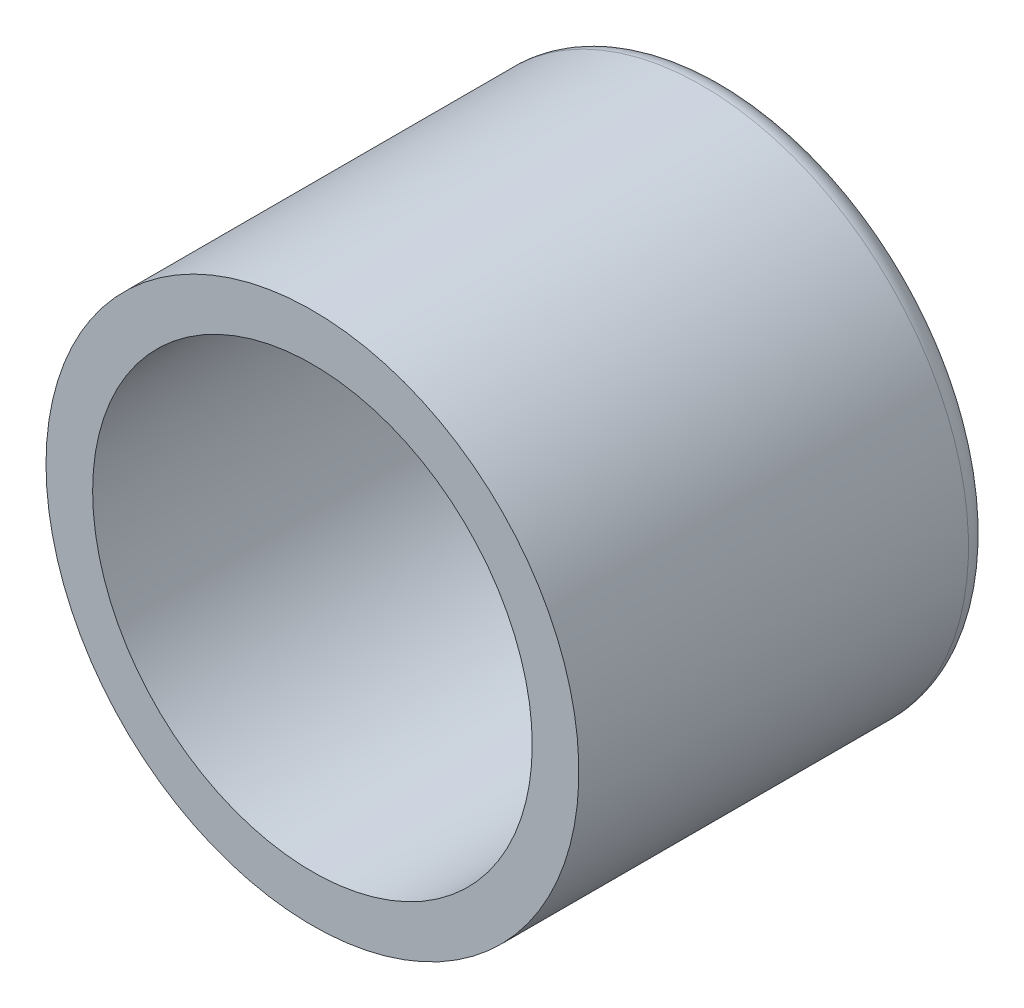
SolidWorks part; units mm, degrees
ref_plane "Plan de face" through (0, 0, 0) normal (0, 0, 1) x (1, 0, 0)
ref_plane "Plan de dessus" through (0, 0, 0) normal (0, 1, 0) x (1, 0, 0)
ref_plane "Plan de droite" through (0, 0, 0) normal (1, 0, 0) x (0, 0, -1)
ref_plane "Plan1" through (0, 0, 0) normal (0, -1, 0) x (1, 0, 0)
sketch "Esquisse1" plane through (0, 0, 0) normal (0, -1, 0) x (1, 0, 0)
  line L0 (6.6, 0.2) -> (0, 0.2)
  line L1 (0, 0.2) -> (0, 0)
  line L2 (0, 0) -> (7.3, 0)
  line L3 (8, 0.7) -> (8, 12.4)
  line L4 (8, 12.4) -> (6.6, 12.4)
  line L5 (6.6, 12.4) -> (6.6, 0.2)
  line L6 (0, 12.4) -> (0, -0.0013) construction
  arc A0 (7.3, 0) -> (8, 0.7) centre (7.3, 0.7) ccw
revolve "Révolution1" add sketch "Esquisse1" angle 360 about L6
